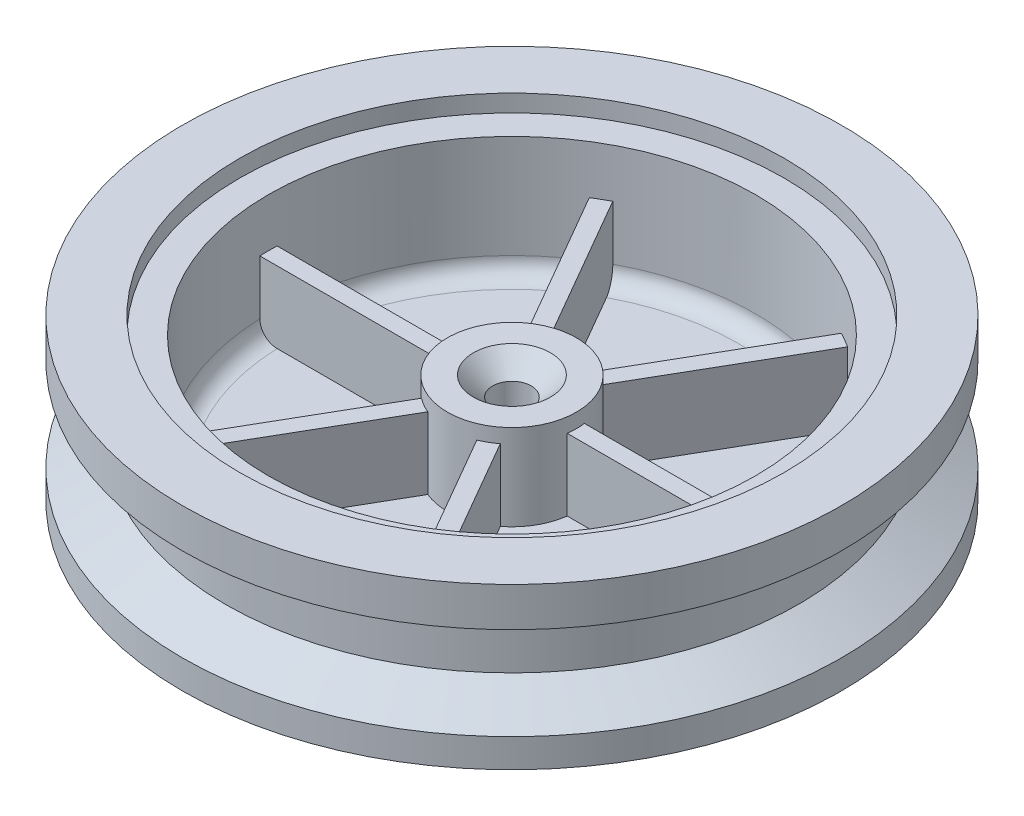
SolidWorks part; units mm, degrees
ref_plane "Front" through (0, 0, 0) normal (0, 0, 1) x (1, 0, 0)
ref_plane "Top" through (0, 0, 0) normal (0, 1, 0) x (1, 0, 0)
ref_plane "Right" through (0, 0, 0) normal (1, 0, 0) x (0, 0, -1)
sketch "Sketch1" plane through (0, 0, 0) normal (0, 0, 1) x (1, 0, 0)
  line L0 (0, 0) -> (93, 0)
  line L1 (93, 0) -> (93, 12)
  line L2 (93, 12) -> (115, 12)
  line L3 (115, 12) -> (115, 22)
  line L4 (115, 68) -> (95, 68)
  line L5 (95, 68) -> (95, 62)
  line L6 (95, 62) -> (85, 62)
  line L7 (85, 62) -> (85, 20)
  line L8 (115, 54.3205) -> (100, 45.6603)
  line L9 (85, 20) -> (22.5, 20)
  line L10 (0, 50) -> (0, 0)
  line L11 (0, 0) -> (0, -33.2608) construction
  line L12 (100, 45.6603) -> (100, 30.6603)
  line L13 (100, 30.6603) -> (115, 22)
  line L14 (115, 54.3205) -> (115, 68)
  line L15 (115, 22) -> (115, 54.3205) construction
  line L16 (100, 38.1603) -> (115, 38.1603) construction
  line L17 (22.5, 20) -> (22.5, 50)
  line L18 (22.5, 50) -> (0, 50)
  dimension "D1" = 186
  dimension "D2" = 230
  dimension "D3" = 190
  dimension "D4" = 170
  dimension "D5" = 68
  dimension "D6" = 12
  dimension "D7" = 6
  dimension "D8" = 60
  dimension "D9" = 200
  dimension "D10" = 48
  dimension "D11" = 15
  dimension "D12" = 10
  dimension "D13" = 45
  dimension "D14" = 30
revolve "Revolve2" add sketch "Sketch1" angle 360 about L11
fillet "Fillet1" radius 6 1 edges at (0, 20, 85)
ref_plane "Plane2" through (0, 45, 0) normal (0, 1, 0) x (1, 0, 0)
sketch "Sketch13" plane through (0, 45, 0) normal (0, 1, 0) x (1, 0, 0)
  line L0 (22.5, 0) -> (85, 0)
  circle A0 centre (0, 0) radius 22.5 construction
  circle A1 centre (0, 0) radius 22.5 construction
  circle A2 centre (0, 0) radius 85 construction
rib "Rib1" sketch "Sketch13" sketch "Sketch13" thickness 6 extrusion direction normal to sketch draft on no parameters "D1"=6
pattern_circular "CirPattern4" count 6 over 360 about axis through (0, 0, 0) along (0, 1, 0) of "Rib1"
sketch "Sketch14" plane through (0, 0, 0) normal (0, 1, 0) x (1, 0, 0)
  circle A0 centre (0, 60) radius 5.75
  circle A1 centre (0, 0) radius 60 construction
  circle A2 centre (0, -60) radius 5.75
  point P7 (0, 0)
  point P8 (0, 60)
  point P9 (0, 0)
  dimension "D1" = 120
  dimension "D2" = 11.5
extrude "Cut-Extrude5" cut sketch "Sketch14" along normal through all
hole_wizard "CSK for M12 Hex Socket Countersunk Cap Screw1" positions "Sketch15" profile "Sketch16" countersink size "M12" standard "ISO"
sketch "Sketch15" plane through (0, 50, 0) normal (0, 1, 0) x (1, 0, 0)
  point P0 (0, 0)
sketch "Sketch16" plane through (0, 50, 0) normal (1, 0, 0) x (0, 0, 1)
  line L0 (0, 0) -> (0, 50)
  line L1 (0, 50) -> (6.75, 50)
  line L2 (6.75, 50) -> (6.75, 6.69)
  line L3 (6.75, 6.69) -> (13.44, 0)
  line L5 (13.44, 0) -> (0, 0)
  line L6 (-6.75, 6.69) -> (-13.44, 0) construction
  line L11 (0, -6.35) -> (0, 107.95) construction
  dimension "Thru Hole Dia." = 13.5
  dimension "Thru Hole Depth" = 50
  dimension "Near C'Sink Dia." = 26.88
  dimension "Near C'Sink Angle" = 90
